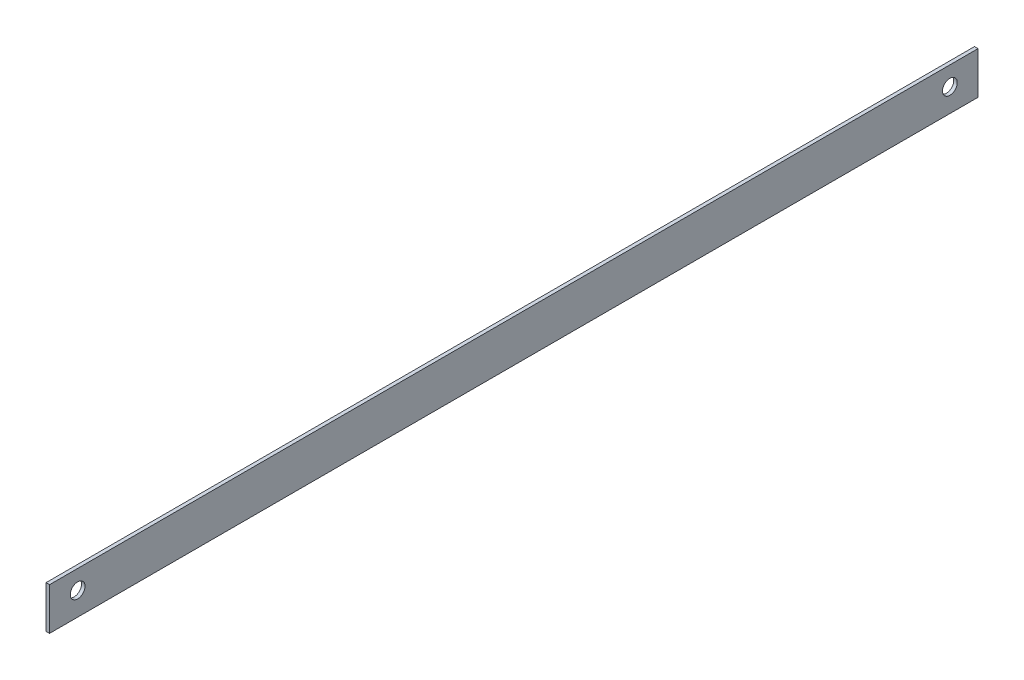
SolidWorks part; units mm, degrees
ref_plane "Plan de face" through (0, 0, 0) normal (0, 0, 1) x (1, 0, 0)
ref_plane "Plan de dessus" through (0, 0, 0) normal (0, 1, 0) x (1, 0, 0)
ref_plane "Plan de droite" through (0, 0, 0) normal (1, 0, 0) x (0, 0, -1)
sketch "Esquisse1" plane through (0, 0, 0) normal (0, 0, 1) x (1, 0, 0)
  line L0 (0, 0) -> (0, 30)
  dimension "D1" = 30
sheet metal parameters "Tôlerie 1" thickness 2.5 parameters "D1"=2.5
base flange "Tôle de base pliée1" sketch "Esquisse1" end condition mid plane depth 660 reverse direction no thickness 2.5 reverse thickness direction no bend radius 2.5
sketch "Esquisse3" plane through (2.5, 0, 0) normal (1, 0, 0) x (0, 0, -1)
  line L1 (-330, 0) -> (-330, 30) construction
  line L2 (-330, 30) -> (330, 30) construction
  circle A0 centre (-310, 16.5) radius 5.25
  circle A1 centre (310, 16.5) radius 5.25
  dimension "D1" = 10.5
  dimension "D2" = 13.5
  dimension "D3" = 20
  dimension "D4" = 620
extrude "Enlèv. mat.-Extru.1" cut sketch "Esquisse3" against normal up to next
flat pattern "Etat déplié1"
sketch "Lignes de pliage1" plane through (0, 0, 0) normal (0, 1, 0) x (-1, 0, 0)
